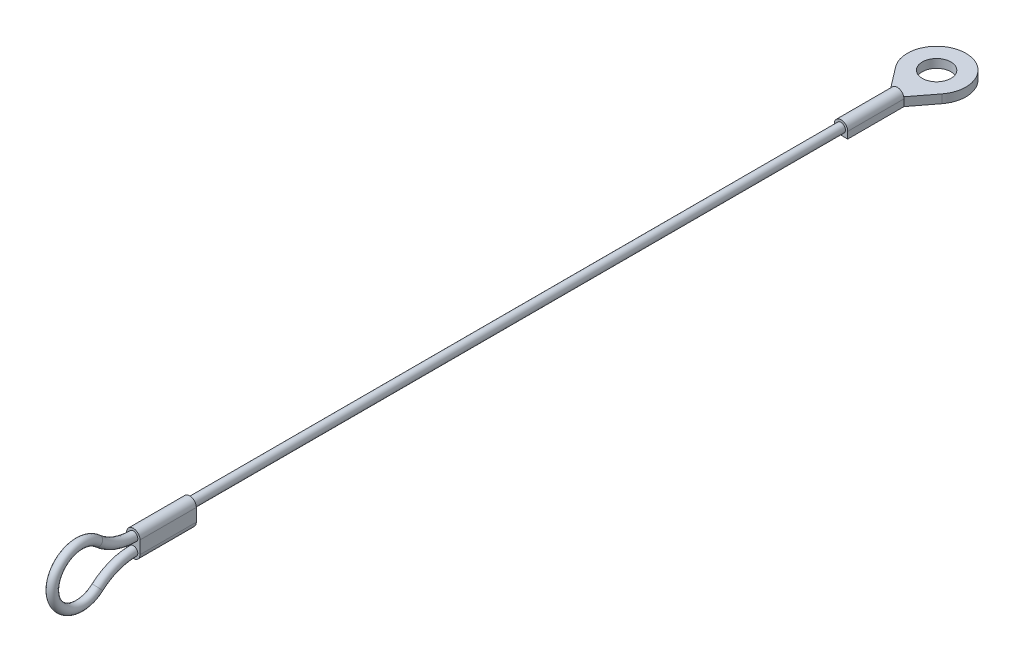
SolidWorks part; units mm, degrees
ref_plane "Front Plane" through (0, 0, 0) normal (0, 0, 1) x (1, 0, 0)
ref_plane "Top Plane" through (0, 0, 0) normal (0, 1, 0) x (1, 0, 0)
ref_plane "Right Plane" through (0, 0, 0) normal (1, 0, 0) x (0, 0, -1)
sketch "Sketch1" plane through (0, 0, 0) normal (1, 0, 0) x (0, 0, -1)
  line L2 (-125.8, 0) -> (0, 0)
  arc A0 (-125.8, 0) -> (-132.2, 2.4446) centre (-125.8, 9.6) cw
  arc A1 (-132.2, 2.4446) -> (-132.2, -4.7108) centre (-135.4, -1.1331) ccw
  arc A2 (-132.2, -4.7108) -> (-125.8, -2.2663) centre (-125.8, -11.8663) cw
  dimension "D1" = 4.8
  dimension "D4" = 9.6
  dimension "D2" = 135.4
  dimension "D3" = 9.6
sketch "Sketch2" plane through (0, 0, 0) normal (0, 0, 1) x (1, 0, 0)
  circle A0 centre (0, 0) radius 0.795
  dimension "D1" = 1.59
sweep "Sweep1" add profiles "Sketch2" path "Sketch1"
sketch "Sketch3" plane through (0, 0, 125.8) normal (0, 0, -1) x (-1, 0, 0)
  line L0 (0, 0) -> (0, -2.2663) construction
  line L1 (1.195, 0) -> (1.195, -2.2663)
  line L2 (-1.195, 0) -> (-1.195, -2.2663)
  line L3 (-0.795, -2.2663) -> (0.795, -2.2663) construction
  arc A0 (1.195, 0) -> (-1.195, 0) centre (0, 0) ccw
  arc A1 (-1.195, -2.2663) -> (1.195, -2.2663) centre (0, -2.2663) ccw
  point P3 (0, -1.1331)
  dimension "D1" = 2.39
extrude "Boss-Extrude1" add sketch "Sketch3" along normal blind 10
sketch "Sketch4" plane through (0, 0, 0) normal (0, 0, -1) x (-1, 0, 0)
  line L0 (-1.195, 0) -> (-1.195, -1.195)
  line L1 (-1.195, -1.195) -> (0, -1.195)
  line L2 (0, -1.195) -> (1.195, -1.195)
  line L3 (1.195, -1.195) -> (1.195, 0)
  arc A0 (1.195, 0) -> (-1.195, 0) centre (0, 0) ccw
  dimension "D1" = 2.39
extrude "Boss-Extrude2" add sketch "Sketch4" along normal blind 10
sketch "Sketch5" plane through (0, -1.195, 0) normal (0, -1, 0) x (1, 0, 0)
  line L0 (-1.195, -10) -> (1.195, -10)
  line L1 (1.195, -10) -> (4.1323, -13.8352)
  line L2 (-4.1323, -13.8352) -> (-1.195, -10)
  arc A0 (4.1323, -13.8352) -> (-4.1323, -13.8352) centre (0, -17) cw
  circle A1 centre (0, -17) radius 2.54
  point P8 (-5.205, -17)
  point P9 (5.205, -17)
  dimension "D1" = 5.08
  dimension "D2" = 10.41
  dimension "D3" = 17
extrude "Boss-Extrude3" add sketch "Sketch5" against normal blind 1.52
